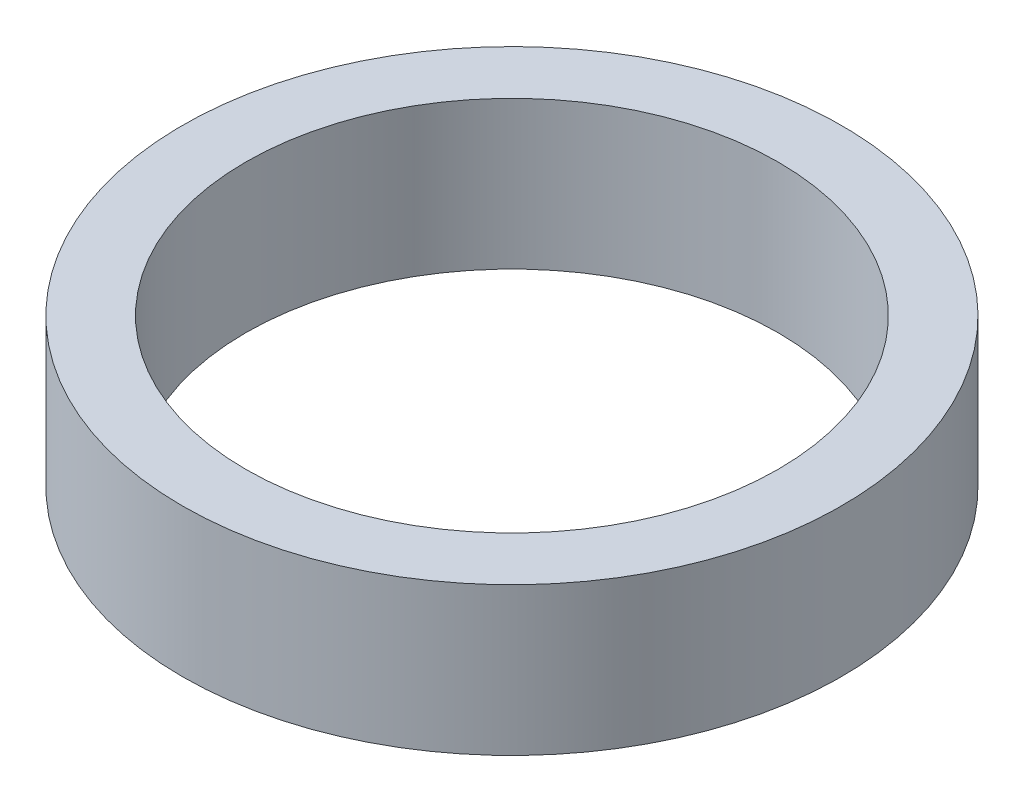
SolidWorks part; units mm, degrees
ref_plane "Front Plane" through (0, 0, 0) normal (0, 0, 1) x (1, 0, 0)
ref_plane "Top Plane" through (0, 0, 0) normal (0, 1, 0) x (1, 0, 0)
ref_plane "Right Plane" through (0, 0, 0) normal (1, 0, 0) x (0, 0, -1)
sketch "Esquisse1" plane through (0, 0, 0) normal (0, 1, 0) x (1, 0, 0)
  circle A0 centre (0, 0) radius 12.6
  circle A1 centre (0, 0) radius 15.6
  dimension "D1" = 3
  dimension "D2" = 25.2
extrude "Boss.-Extru.1" add sketch "Esquisse1" along normal blind 7
